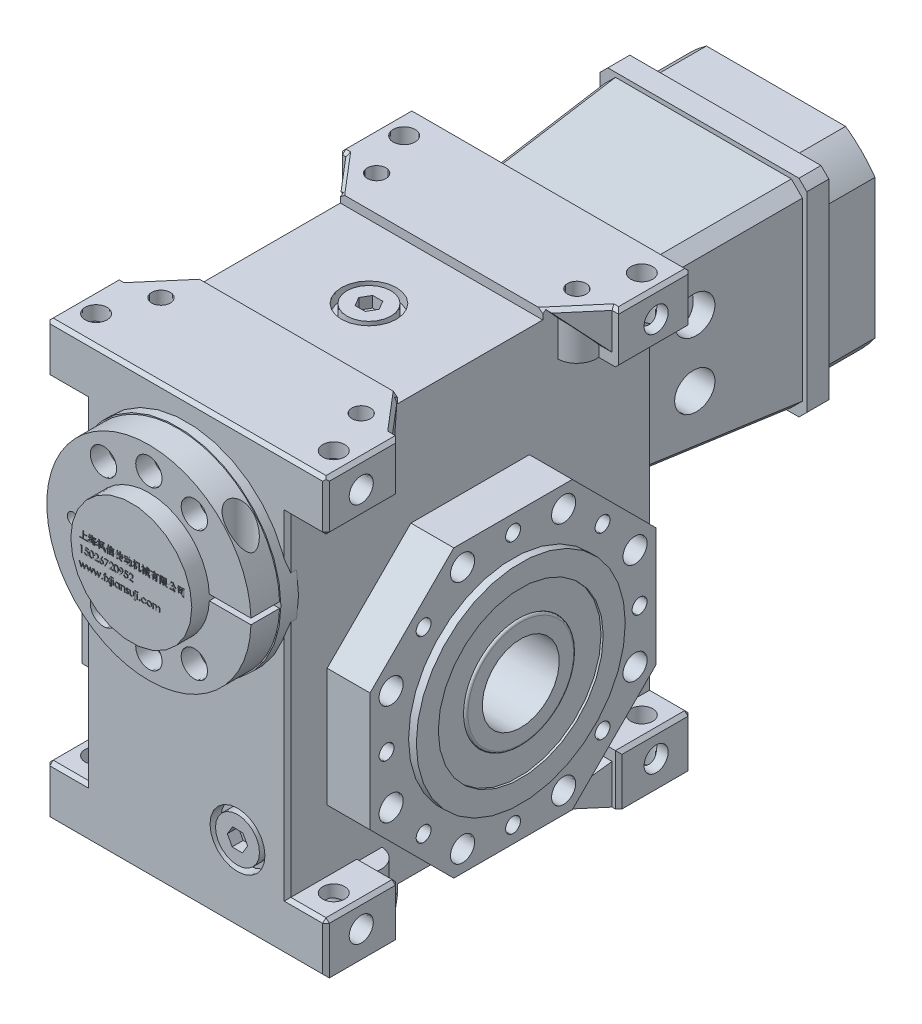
SolidWorks part; units mm, degrees
ref_plane "前视基准面" through (0, 0, 0) normal (0, 0, 1) x (1, 0, 0)
ref_plane "上视基准面" through (0, 0, 0) normal (0, 1, 0) x (1, 0, 0)
ref_plane "右视基准面" through (0, 0, 0) normal (1, 0, 0) x (0, 0, -1)
imported_body "JDLB063-CR箱体-1-solid1"
imported_body "JDLB063-CR箱体-1-solid2"
imported_body "JDLB063-C1空心轴Φ35-1-solid1"
imported_body "JDLB063-ST94输入法兰-1-solid1"
imported_body "JDLB063-C1锁紧盘-44-80-25-1-solid1"
imported_body "JDLB063-C1锁紧盘-44-80-25-1-solid2"
imported_body "JDLB063-C1锁紧盘-44-80-25-1-solid3"
imported_body "ST90-70-90-M6伺服法兰接口-1-solid1"
imported_body "联轴器BD56-60-20-19锁紧-1-solid1"
imported_body "联轴器BD56-60-20-19锁紧-1-solid2"
imported_body "联轴器BD56-60-20-19锁紧-1-solid3"
imported_body "联轴器BD56-60-20-19锁紧-1-solid4"
imported_body "联轴器BD56-60-20-19锁紧-1-solid5"
imported_body "联轴器BD56-60-20-19锁紧-1-solid6"
imported_body "联轴器BD56-60-20-19锁紧-1-solid7"
imported_body "联轴器BD56-60-20-19锁紧-1-solid8"
imported_body "联轴器BD56-60-20-19锁紧-1-solid9"
imported_body "联轴器BD56-60-20-19锁紧-1-solid10"
imported_body "联轴器BD56-60-20-19锁紧-1-solid11"
sketch "草图1" plane through (47, 0, 0) normal (1, 0, 0) x (0, 0, -1)
  line L1 (-31.2864, 102.9022) -> (35.4658, 102.9022)
  line L2 (-31.2864, 102.9022) -> (-31.2864, 84.0583)
  line L3 (-31.2864, 84.0583) -> (35.4658, 84.0583)
  line L4 (35.4658, 102.9022) -> (35.4658, 84.0583)
extrude "切除-拉伸1" cut sketch "草图1" against normal up to surface (1 mm away)
sketch "草图2" plane through (-47, 0, 0) normal (-1, 0, 0) x (0, 0, 1)
  line L1 (-27.1617, 100.9859) -> (29.6894, 100.9859)
  line L2 (-27.1617, 100.9859) -> (-27.1617, 86.294)
  line L3 (-27.1617, 86.294) -> (29.6894, 86.294)
  line L4 (29.6894, 100.9859) -> (29.6894, 86.294)
extrude "切除-拉伸2" cut sketch "草图2" against normal up to surface (1 mm away)
sketch "草图3" plane through (0, 0, 108) normal (0, 0, 1) x (1, 0, 0)
  text T0 "上海枫信传动机械有限公司  15026720952  www.fxjiansuji.com" font "Century Gothic" height in points 11
extrude "凸台-拉伸1" add sketch "草图3" along normal blind 0.2
